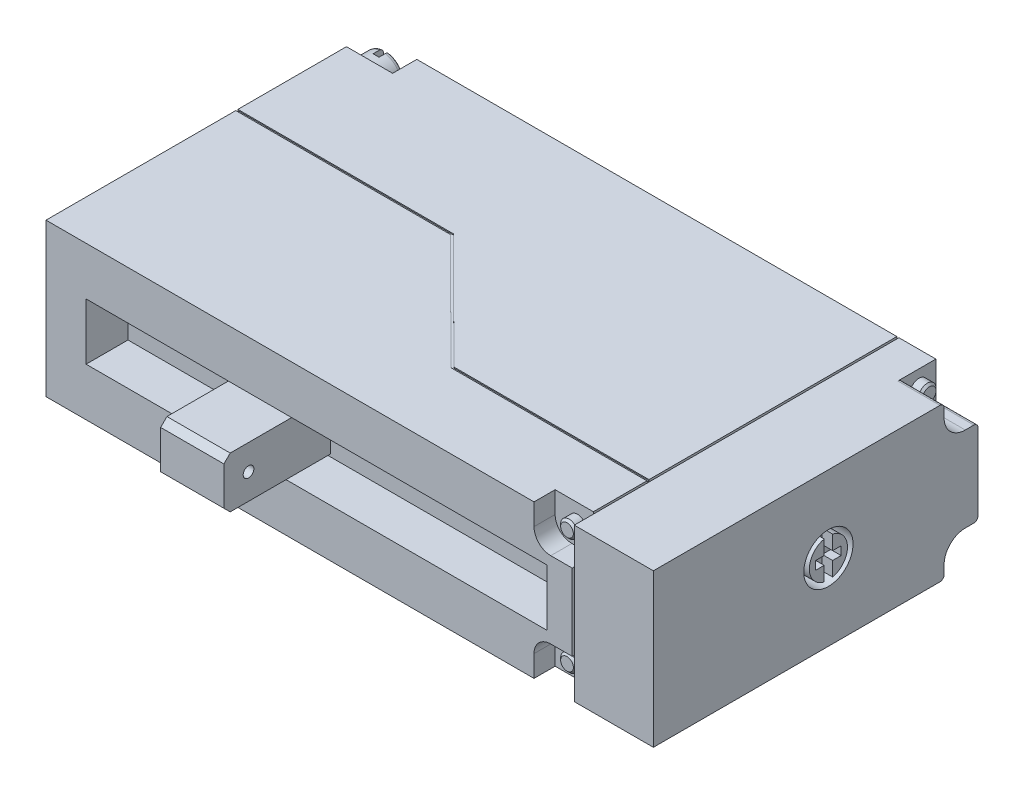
SolidWorks part; units mm, degrees
ref_plane "Front Plane" through (0, 0, 0) normal (0, 0, 1) x (1, 0, 0)
ref_plane "Top Plane" through (0, 0, 0) normal (0, 1, 0) x (1, 0, 0)
ref_plane "Right Plane" through (0, 0, 0) normal (1, 0, 0) x (0, 0, -1)
sketch "Sketch1" plane through (0, 0, 0) normal (0, 0, 1) x (1, 0, 0)
  line L1 (14.5, -3.65) -> (-14.5, -3.65)
  line L2 (14.5, -3.65) -> (14.5, 3.65)
  line L3 (14.5, 3.65) -> (-14.5, 3.65)
  line L4 (-14.5, -3.65) -> (-14.5, 3.65)
  line L5 (14.5, -3.65) -> (-14.5, 3.65) construction
  line L6 (14.5, 3.65) -> (-14.5, -3.65) construction
  point P0 (0, 0)
  dimension "D1" = 29
  dimension "D2" = 7.3
extrude "Boss-Extrude1" add sketch "Sketch1" along normal blind 15.5
sketch "Sketch4" plane through (0, 3.65, 0) normal (0, 1, 0) x (1, 0, 0)
  line L0 (14.5, -15.5) -> (14.5, 0) construction
  line L1 (14.5, 0) -> (-14.5, 0) construction
  line B0 (-14.3994, -0.4521) -> (-14.3994, -0.9538)
  line B1 (-12.5864, -0.9538) -> (-12.5864, -0.4521)
  line B2 (-12.7876, -1.1539) -> (-12.7544, -1.1517)
  line B3 (-12.7544, -1.1517) -> (-12.7188, -1.142)
  line B4 (-12.7188, -1.142) -> (-12.6882, -1.1281)
  line B5 (-12.6882, -1.1281) -> (-12.6597, -1.1067)
  line B6 (-12.6597, -1.1067) -> (-12.6336, -1.0831)
  line B7 (-12.6336, -1.0831) -> (-12.6147, -1.0526)
  line B8 (-12.6147, -1.0526) -> (-12.5982, -1.0219)
  line B9 (-12.5982, -1.0219) -> (-12.5887, -0.9891)
  line B10 (-14.3994, -0.9538) -> (-14.3972, -0.9891)
  line B11 (-14.3972, -0.9891) -> (-14.3874, -1.022)
  line B12 (-14.3874, -1.022) -> (-14.3735, -1.0527)
  line B13 (-14.3735, -1.0527) -> (-14.352, -1.083)
  line B14 (-14.352, -1.083) -> (-14.3283, -1.1066)
  line B15 (-14.3283, -1.1066) -> (-14.2975, -1.1282)
  line B16 (-14.2975, -1.1282) -> (-14.2668, -1.142)
  line B17 (-14.2668, -1.142) -> (-14.2339, -1.1518)
  line B18 (-14.2339, -1.1518) -> (-14.1982, -1.1539)
  line B19 (-14.1983, -0.252) -> (-14.2339, -0.2542)
  line B20 (-14.2339, -0.2542) -> (-14.2669, -0.2635)
  line B21 (-14.2669, -0.2635) -> (-14.2976, -0.2778)
  line B22 (-14.2976, -0.2778) -> (-14.3282, -0.2988)
  line B23 (-14.3282, -0.2988) -> (-14.3519, -0.3224)
  line B24 (-14.3519, -0.3224) -> (-14.3735, -0.3509)
  line B25 (-14.3735, -0.3509) -> (-14.3875, -0.3837)
  line B26 (-14.3875, -0.3837) -> (-14.3972, -0.4169)
  line B27 (-14.3972, -0.4169) -> (-14.3994, -0.4521)
  line B28 (-12.5864, -0.4521) -> (-12.5889, -0.4168)
  line B29 (-12.5889, -0.4168) -> (-12.5984, -0.3837)
  line B30 (-12.5984, -0.3837) -> (-12.6147, -0.3508)
  line B31 (-12.6147, -0.3508) -> (-12.6336, -0.3225)
  line B32 (-12.6336, -0.3225) -> (-12.6598, -0.299)
  line B33 (-12.6598, -0.299) -> (-12.6881, -0.2777)
  line B34 (-12.6881, -0.2777) -> (-12.7189, -0.2635)
  line B35 (-12.7189, -0.2635) -> (-12.7543, -0.2542)
  line B36 (-12.7543, -0.2542) -> (-12.7876, -0.252)
  line B37 (-14.5013, -11.3824) -> (-14.6006, -11.3824)
  line B38 (-14.6006, -12.3856) -> (-14.5013, -12.3856)
  line B39 (-14.6006, -11.3824) -> (-14.7024, -11.4837)
  line B40 (10.2728, -14.7924) -> (10.2728, -14.4911)
  line B41 (9.4658, -14.7924) -> (9.6669, -14.9929)
  line B42 (12.8907, -0.5534) -> (12.4885, -0.5534)
  line B43 (12.8907, -1.3543) -> (12.9902, -1.255)
  line B44 (12.9902, -0.6523) -> (12.8907, -0.5534)
  line B45 (-13.6326, -0.7534) -> (-13.6704, -0.4522)
  line B46 (-13.6326, -0.7534) -> (-13.3533, -0.7534)
  line B47 (-13.3155, -0.4521) -> (-13.3533, -0.7534)
  line B48 (-14.1983, -0.252) -> (-13.694, -0.252)
  line B49 (-13.694, -0.252) -> (-13.694, -0.2542)
  line B50 (-13.694, -0.2542) -> (-13.694, -0.259)
  line B51 (-13.694, -0.259) -> (-13.6918, -0.2661)
  line B52 (-13.6918, -0.2661) -> (-13.6918, -0.2756)
  line B53 (-13.6918, -0.2756) -> (-13.6894, -0.2849)
  line B54 (-13.6894, -0.2849) -> (-13.6869, -0.3085)
  line B55 (-13.6869, -0.3085) -> (-13.6844, -0.339)
  line B56 (-13.6844, -0.339) -> (-13.6801, -0.3745)
  line B57 (-13.6801, -0.3745) -> (-13.6751, -0.4123)
  line B58 (-13.3155, -0.4521) -> (-13.3105, -0.4123)
  line B59 (-13.3105, -0.4123) -> (-13.306, -0.3744)
  line B60 (-13.306, -0.3744) -> (-13.3035, -0.3392)
  line B61 (-13.3035, -0.3392) -> (-13.299, -0.3084)
  line B62 (-13.299, -0.3084) -> (-13.2964, -0.2849)
  line B63 (-13.2964, -0.2849) -> (-13.294, -0.2756)
  line B64 (-13.294, -0.2756) -> (-13.294, -0.2663)
  line B65 (-13.294, -0.2663) -> (-13.2918, -0.2589)
  line B66 (-13.2918, -0.2589) -> (-13.2918, -0.2542)
  line B67 (-13.2918, -0.2542) -> (-13.2918, -0.252)
  line B68 (-13.694, -0.252) -> (-14.0964, -0.252)
  line B69 (-12.8892, -0.252) -> (-13.2918, -0.252)
  line B70 (-5.926, -18.219) -> (-2.9059, -18.219)
  line B71 (-2.9059, -18.219) -> (-2.9059, -15.4944)
  line B72 (-5.926, -18.219) -> (-5.926, -15.4944)
  line B73 (-2.9059, -18.5206) -> (-5.9261, -18.5206)
  line B74 (13.9983, -15.4944) -> (10.6752, -15.4944)
  line B75 (10.6752, -15.4944) -> (10.6752, -15.2939)
  line B76 (10.6752, 0) -> (12.4884, 0)
  line B77 (12.4884, 0) -> (12.4884, -1.7546)
  line B78 (10.6752, -0.3509) -> (10.6752, -15.2939)
  line B79 (14.5, -1.9571) -> (14.5, -15.294)
  line B80 (14.5, -1.9571) -> (14.4978, -1.9218)
  line B81 (14.4978, -1.9218) -> (14.4883, -1.8887)
  line B82 (14.4883, -1.8887) -> (14.4742, -1.8558)
  line B83 (14.4742, -1.8558) -> (14.4551, -1.8275)
  line B84 (14.4551, -1.8275) -> (14.4292, -1.8017)
  line B85 (14.4292, -1.8017) -> (14.4008, -1.7827)
  line B86 (14.4008, -1.7827) -> (14.3676, -1.7684)
  line B87 (14.3676, -1.7684) -> (14.3343, -1.7592)
  line B88 (14.3343, -1.7592) -> (14.2991, -1.7548)
  line B89 (14.299, -15.4944) -> (14.3345, -15.492)
  line B90 (14.3345, -15.492) -> (14.3677, -15.4827)
  line B91 (14.3677, -15.4827) -> (14.4007, -15.4685)
  line B92 (14.4007, -15.4685) -> (14.4291, -15.4473)
  line B93 (14.4291, -15.4473) -> (14.4552, -15.4239)
  line B94 (14.4552, -15.4239) -> (14.4741, -15.3954)
  line B95 (14.4741, -15.3954) -> (14.4884, -15.3623)
  line B96 (14.4884, -15.3623) -> (14.4978, -15.3294)
  line B97 (14.299, -15.4944) -> (13.9983, -15.4944)
  line B98 (12.4884, 0) -> (14.2992, 0)
  line B99 (14.5, -0.2002) -> (14.5, -0.7534)
  line B100 (14.5, -0.2002) -> (14.4978, -0.1671)
  line B101 (14.4978, -0.1671) -> (14.4883, -0.1317)
  line B102 (14.4883, -0.1317) -> (14.4742, -0.1011)
  line B103 (14.4742, -0.1011) -> (14.4551, -0.0726)
  line B104 (14.4551, -0.0726) -> (14.4292, -0.0469)
  line B105 (14.4292, -0.0469) -> (14.4008, -0.0281)
  line B106 (14.4008, -0.0281) -> (14.3676, -0.0118)
  line B107 (14.3676, -0.0118) -> (14.3343, -0.0045)
  line B108 (-14.5013, -6.3893) -> (-13.997, -6.3893)
  line B109 (-14.5013, -1.1539) -> (-13.997, -1.1539)
  line B110 (10.6752, -11.884) -> (1.2905, -11.884)
  line B111 (-4.229, -6.3893) -> (1.2906, -11.884)
  line B112 (10.6752, -11.884) -> (10.6752, 0)
  line B113 (-4.229, -6.3893) -> (-13.997, -6.3893)
  line B114 (-13.997, -1.1539) -> (-12.2953, -1.1539)
  line B115 (-12.0939, 0) -> (-12.1272, -0.0043)
  line B116 (-12.1272, -0.0043) -> (-12.1627, -0.0119)
  line B117 (-12.1627, -0.0119) -> (-12.1934, -0.0281)
  line B118 (-12.1934, -0.0281) -> (-12.222, -0.0467)
  line B119 (-12.222, -0.0467) -> (-12.2479, -0.0727)
  line B120 (-12.2479, -0.0727) -> (-12.267, -0.1012)
  line B121 (-12.267, -0.1012) -> (-12.2835, -0.1317)
  line B122 (-12.2835, -0.1317) -> (-12.2905, -0.1672)
  line B123 (-12.0939, 0) -> (10.6752, 0)
  line B124 (9.4658, -14.7924) -> (10.2728, -14.7924)
  line B125 (12.8907, -1.3543) -> (12.8907, -0.5534)
  line B126 (-13.4787, 0) -> (-12.0939, 0)
  line B127 (-14.2976, 0) -> (-14.3332, -0.0043)
  line B128 (-14.3332, -0.0043) -> (-14.3686, -0.0119)
  line B129 (-14.3686, -0.0119) -> (-14.3994, -0.0281)
  line B130 (-14.3994, -0.0281) -> (-14.4277, -0.0467)
  line B131 (-14.4277, -0.0467) -> (-14.4539, -0.0727)
  line B132 (-14.4539, -0.0727) -> (-14.4728, -0.1012)
  line B133 (-14.4728, -0.1012) -> (-14.4869, -0.1317)
  line B134 (-14.4869, -0.1317) -> (-14.4965, -0.1672)
  line B135 (-14.4965, -0.1672) -> (-14.5012, -0.2002)
  line B136 (-13.997, -15.4944) -> (-14.2976, -15.4944)
  line B137 (-14.5013, -15.294) -> (-14.4966, -15.3295)
  line B138 (-14.4966, -15.3295) -> (-14.487, -15.3623)
  line B139 (-14.487, -15.3623) -> (-14.4727, -15.3954)
  line B140 (-14.4727, -15.3954) -> (-14.454, -15.4238)
  line B141 (-14.454, -15.4238) -> (-14.4277, -15.4471)
  line B142 (-14.4277, -15.4471) -> (-14.3993, -15.4685)
  line B143 (-14.3993, -15.4685) -> (-14.3686, -15.4828)
  line B144 (-14.3686, -15.4828) -> (-14.333, -15.4921)
  line B145 (-14.5013, -6.3893) -> (-13.997, -6.3893)
  line B146 (-14.5013, -15.294) -> (-14.5013, -6.3893)
  line B147 (10.6752, -11.884) -> (1.2905, -11.884)
  line B148 (10.6752, -14.4911) -> (10.6752, -11.884)
  line B149 (8.8717, -14.4911) -> (10.6752, -14.4911)
  line B150 (-4.229, -6.3893) -> (-13.997, -6.3893)
  line B151 (8.5995, -15.4944) -> (8.6373, -15.492)
  line B152 (8.6373, -15.492) -> (8.6729, -15.4804)
  line B153 (8.6729, -15.4804) -> (8.7061, -15.4637)
  line B154 (8.7061, -15.4637) -> (8.7346, -15.4425)
  line B155 (8.7346, -15.4425) -> (8.7604, -15.4144)
  line B156 (8.7604, -15.4144) -> (8.7793, -15.3835)
  line B157 (8.7793, -15.3835) -> (8.7936, -15.3486)
  line B158 (8.7936, -15.3486) -> (8.8006, -15.3106)
  line B159 (9.88, -15.4944) -> (8.5995, -15.4944)
  line B160 (10.6752, -15.4944) -> (9.88, -15.4944)
  line B161 (-14.2976, -1.1281) -> (-14.2976, -1.1539)
  line B162 (14.5, -15.294) -> (14.4957, -15.294)
  line B163 (-14.5013, -15.294) -> (-14.5057, -15.294)
  spline B164 degree 2 poles (-12.5887, -0.9891) (-12.5865, -0.9538) (-12.5864, -0.9538) knots 0.8 0.8 0.8 1 1 1
  spline B165 degree 2 poles (-14.7024, -12.2866) (-14.6005, -12.3856) (-14.6006, -12.3856) knots 0 0 0 1 1 1
  spline B166 degree 2 poles (9.4658, -14.4911) (9.4658, -14.7923) (9.4658, -14.7924) knots 0 0 0 1 1 1
  spline B167 degree 2 poles (10.0693, -14.9928) (10.2727, -14.7924) (10.2728, -14.7924) knots 0 0 0 1 1 1
  spline B168 degree 2 poles (12.4884, -1.3543) (12.8906, -1.3543) (12.8907, -1.3543) knots 0 0 0 1 1 1
  spline B169 degree 2 poles (-13.6751, -0.4123) (-13.6705, -0.4521) (-13.6704, -0.4522) knots 0.818182 0.818182 0.818182 1 1 1
  spline B170 degree 2 poles (-13.2918, -0.252) (-12.7875, -0.252) (-12.7876, -0.252) knots 0 0 0 1 1 1
  spline B171 degree 2 poles (-2.9059, -18.219) (-2.9059, -18.5205) (-2.9059, -18.5206) knots 0 0 0 1 1 1
  spline B172 degree 2 poles (-5.9261, -18.5206) (-5.926, -18.5206) (-5.926, -18.2191) knots 0 0 0 1 1 1
  spline B173 degree 2 poles (-14.7024, -12.2866) (-14.7024, -11.4836) (-14.7024, -11.4837) knots 0 0 0 1 1 1
  spline B174 degree 2 poles (12.4884, -1.7546) (12.4884, -1.7547) (13.9984, -1.7547) knots 0 0 0 1 1 1
  spline B175 degree 2 poles (13.9984, -1.7547) (13.9983, -1.7547) (14.2991, -1.7547) knots 0 0 0 1 1 1
  spline B176 degree 2 poles (14.4978, -15.3294) (14.5, -15.2939) (14.5, -15.294) knots 0.8 0.8 0.8 1 1 1
  spline B177 degree 2 poles (14.5, -0.7534) (14.5, -1.957) (14.5, -1.9571) knots 0 0 0 1 1 1
  spline B178 degree 2 poles (14.3343, -0.0045) (14.2991, 0) (14.2992, 0) knots 0.8 0.8 0.8 1 1 1
  spline B179 degree 2 poles (-14.5013, -6.3893) (-14.5013, -1.1538) (-14.5013, -1.1539) knots 0 0 0 1 1 1
  spline B180 degree 2 poles (-12.2905, -0.1672) (-12.2954, -0.2002) (-12.2954, -0.2003) knots 0.8 0.8 0.8 1 1 1
  spline B181 degree 2 poles (-12.2953, -1.1539) (-12.2954, -1.1539) (-12.2954, -0.2003) knots 0 0 0 1 1 1
  spline B182 degree 2 poles (10.0693, -14.9928) (9.667, -14.9928) (9.6669, -14.9929) knots 0 0 0 1 1 1
  spline B183 degree 2 poles (12.9902, -0.6523) (12.9902, -1.2551) (12.9902, -1.255) knots 0 0 0 1 1 1
  spline B184 degree 2 poles (-14.5013, -1.1539) (-14.5013, -0.2003) (-14.5012, -0.2002) knots 0 0 0 1 1 1
  spline B185 degree 2 poles (-14.2976, 0) (-13.4788, 0) (-13.4787, 0) knots 0 0 0 1 1 1
  spline B186 degree 2 poles (-14.5013, -5.5862) (-14.5013, -6.3894) (-14.5013, -6.3893) knots 0 0 0 1 1 1
  spline B187 degree 2 poles (-14.333, -15.4921) (-14.2976, -15.4945) (-14.2976, -15.4944) knots 0.8 0.8 0.8 1 1 1
  spline B188 degree 2 poles (8.5995, -15.4944) (-13.9971, -15.4944) (-13.997, -15.4944) knots 0 0 0 1 1 1
  spline B189 degree 2 poles (1.2906, -11.884) (-4.229, -6.3894) (-4.229, -6.3893) knots 0 0 0 1 1 1
  spline B190 degree 2 poles (8.8717, -14.4911) (8.8007, -15.3107) (8.8006, -15.3106) knots 0 0 0 1 1 1
sketch_block_instance "Block1-1"
sketch_block "Block1"
ref_plane "Central plane" through (0, 0, 0) normal (0, 1, 0) x (1, 0, 0)
sketch "Sketch5" plane through (14.5, 0, 0) normal (1, 0, 0) x (0, 0, -1)
  line L0 (-1.9571, 3.65) -> (-15.294, 3.65) construction
  line L1 (0, -3.65) -> (0, 3.65) construction
  line B0 (-7.3201, 0.8942) -> (-7.3939, 0.8775)
  line B1 (-7.3939, 0.8775) -> (-7.4654, 0.8535)
  line B2 (-7.4654, 0.8535) -> (-7.5368, 0.8227)
  line B3 (-7.5368, 0.8227) -> (-7.6034, 0.787)
  line B4 (-7.6034, 0.787) -> (-7.6672, 0.7463)
  line B5 (-7.6672, 0.7463) -> (-7.7268, 0.6986)
  line B6 (-7.7268, 0.6986) -> (-7.7839, 0.6485)
  line B7 (-7.7839, 0.6485) -> (-7.8339, 0.5936)
  line B8 (-7.8339, 0.5936) -> (-7.8817, 0.5342)
  line B9 (-7.8817, 0.5342) -> (-7.9246, 0.4698)
  line B10 (-7.9246, 0.4698) -> (-7.9602, 0.4031)
  line B11 (-7.9602, 0.4031) -> (-7.9912, 0.334)
  line B12 (-7.9912, 0.334) -> (-8.0148, 0.2625)
  line B13 (-8.0148, 0.2625) -> (-8.034, 0.1885)
  line B14 (-8.034, 0.1885) -> (-8.0456, 0.1122)
  line B15 (-8.0456, 0.1122) -> (-8.0528, 0.0385)
  line B16 (-8.0528, 0.0385) -> (-8.0528, -0.0379)
  line B17 (-8.0528, -0.0379) -> (-8.0456, -0.1142)
  line B18 (-8.0456, -0.1142) -> (-8.034, -0.1905)
  line B19 (-8.034, -0.1905) -> (-8.0148, -0.2621)
  line B20 (-8.0148, -0.2621) -> (-7.9912, -0.336)
  line B21 (-7.9912, -0.336) -> (-7.9602, -0.4052)
  line B22 (-7.9602, -0.4052) -> (-7.9246, -0.4718)
  line B23 (-7.9246, -0.4718) -> (-7.8817, -0.5337)
  line B24 (-7.8817, -0.5337) -> (-7.8339, -0.5935)
  line B25 (-7.8339, -0.5935) -> (-7.7839, -0.6506)
  line B26 (-7.7839, -0.6506) -> (-7.7268, -0.7007)
  line B27 (-7.7268, -0.7007) -> (-7.6672, -0.7485)
  line B28 (-7.6672, -0.7485) -> (-7.6034, -0.789)
  line B29 (-7.6034, -0.789) -> (-7.5368, -0.8249)
  line B30 (-7.5368, -0.8249) -> (-7.4654, -0.8533)
  line B31 (-7.4654, -0.8533) -> (-7.3939, -0.8769)
  line B32 (-7.3939, -0.8769) -> (-7.3201, -0.8962)
  line B33 (-7.3201, 0.8942) -> (-7.3249, 0.8893)
  line B34 (-7.3249, 0.8893) -> (-7.3273, 0.8846)
  line B35 (-7.3273, 0.8846) -> (-7.3297, 0.8775)
  line B36 (-7.3297, 0.8775) -> (-7.3319, 0.8679)
  line B37 (-7.3319, 0.8679) -> (-7.3343, 0.8561)
  line B38 (-7.3343, 0.8561) -> (-7.3367, 0.8296)
  line B39 (-7.3367, 0.8296) -> (-7.3417, 0.7964)
  line B40 (-7.3417, 0.7964) -> (-7.3439, 0.7605)
  line B41 (-7.3439, 0.7605) -> (-7.3439, 0.6796)
  line B42 (-7.3439, -0.6817) -> (-7.3439, -0.7604)
  line B43 (-7.3439, -0.7604) -> (-7.3417, -0.7985)
  line B44 (-7.3417, -0.7985) -> (-7.3367, -0.8295)
  line B45 (-7.3367, -0.8295) -> (-7.3343, -0.858)
  line B46 (-7.3343, -0.858) -> (-7.3317, -0.8676)
  line B47 (-7.3317, -0.8676) -> (-7.3297, -0.8771)
  line B48 (-7.3297, -0.8771) -> (-7.3273, -0.8867)
  line B49 (-7.3273, -0.8867) -> (-7.3249, -0.8915)
  line B50 (-7.3249, -0.8915) -> (-7.3201, -0.8962)
  line B51 (-7.3201, -0.8962) -> (-7.2823, -0.9035)
  line B52 (-7.344, -0.2025) -> (-7.3439, -0.6817)
  line B53 (-6.9396, 0.6795) -> (-6.9396, 0.7201)
  line B54 (-6.9396, 0.7201) -> (-6.9418, 0.7606)
  line B55 (-6.9418, 0.7606) -> (-6.9442, 0.7964)
  line B56 (-6.9442, 0.7964) -> (-6.9466, 0.8297)
  line B57 (-6.9466, 0.8297) -> (-6.9512, 0.8559)
  line B58 (-6.9512, 0.8559) -> (-6.9512, 0.868)
  line B59 (-6.9512, 0.868) -> (-6.9536, 0.8752)
  line B60 (-6.9536, 0.8752) -> (-6.956, 0.8846)
  line B61 (-6.956, 0.8846) -> (-6.9586, 0.8894)
  line B62 (-6.9586, 0.8894) -> (-6.9608, 0.8918)
  line B63 (-6.9608, 0.8918) -> (-6.9632, 0.8942)
  line B64 (-6.9633, -0.8962) -> (-6.8897, -0.877)
  line B65 (-6.8897, -0.877) -> (-6.8182, -0.8534)
  line B66 (-6.8182, -0.8534) -> (-6.7492, -0.8249)
  line B67 (-6.7492, -0.8249) -> (-6.6827, -0.789)
  line B68 (-6.6827, -0.789) -> (-6.6181, -0.7486)
  line B69 (-6.6181, -0.7486) -> (-6.5567, -0.7007)
  line B70 (-6.5567, -0.7007) -> (-6.5015, -0.6506)
  line B71 (-6.5015, -0.6506) -> (-6.4494, -0.5935)
  line B72 (-6.4494, -0.5935) -> (-6.4016, -0.5338)
  line B73 (-6.4016, -0.5338) -> (-6.3612, -0.4719)
  line B74 (-6.3612, -0.4719) -> (-6.3234, -0.4052)
  line B75 (-6.3234, -0.4052) -> (-6.2949, -0.336)
  line B76 (-6.2949, -0.336) -> (-6.2685, -0.2621)
  line B77 (-6.2685, -0.2621) -> (-6.2495, -0.1906)
  line B78 (-6.2495, -0.1906) -> (-6.2375, -0.1143)
  line B79 (-6.2375, -0.1143) -> (-6.2305, -0.0379)
  line B80 (-6.2305, -0.0379) -> (-6.2305, 0.0385)
  line B81 (-6.2305, 0.0385) -> (-6.2375, 0.1122)
  line B82 (-6.2375, 0.1122) -> (-6.2495, 0.1885)
  line B83 (-6.2495, 0.1885) -> (-6.2685, 0.2625)
  line B84 (-6.2685, 0.2625) -> (-6.2949, 0.334)
  line B85 (-6.2949, 0.334) -> (-6.3234, 0.4031)
  line B86 (-6.3234, 0.4031) -> (-6.3612, 0.4698)
  line B87 (-6.3612, 0.4698) -> (-6.4016, 0.5341)
  line B88 (-6.4016, 0.5341) -> (-6.4494, 0.5938)
  line B89 (-6.4494, 0.5938) -> (-6.5015, 0.6485)
  line B90 (-6.5015, 0.6485) -> (-6.5567, 0.6986)
  line B91 (-6.5567, 0.6986) -> (-6.6181, 0.7463)
  line B92 (-6.6181, 0.7463) -> (-6.6827, 0.7869)
  line B93 (-6.6827, 0.7869) -> (-6.7492, 0.8226)
  line B94 (-6.7492, 0.8226) -> (-6.8182, 0.8535)
  line B95 (-6.8182, 0.8535) -> (-6.8897, 0.8775)
  line B96 (-6.8897, 0.8775) -> (-6.9633, 0.8942)
  line B97 (-6.9633, -0.8962) -> (-6.9587, -0.8914)
  line B98 (-6.9587, -0.8914) -> (-6.9561, -0.8842)
  line B99 (-6.9561, -0.8842) -> (-6.9536, -0.877)
  line B100 (-6.9536, -0.877) -> (-6.9511, -0.8676)
  line B101 (-6.9511, -0.8676) -> (-6.9511, -0.8581)
  line B102 (-6.9511, -0.8581) -> (-6.9467, -0.8295)
  line B103 (-6.9467, -0.8295) -> (-6.9443, -0.7985)
  line B104 (-6.9443, -0.7985) -> (-6.9418, -0.7604)
  line B105 (-6.9418, -0.7604) -> (-6.9397, -0.7221)
  line B106 (-6.9397, -0.7221) -> (-6.9397, -0.6816)
  line B107 (-6.9633, 0.8942) -> (-7.0011, 0.9014)
  line B108 (-6.9395, 0.2027) -> (-6.9396, 0.6795)
  line B109 (-7.2821, 0.9013) -> (-7.32, 0.8941)
  line B110 (-7.3439, 0.6796) -> (-7.3439, 0.2028)
  line B111 (-7.0012, -0.9033) -> (-6.9633, -0.8962)
  line B112 (-6.9397, -0.6816) -> (-6.9396, -0.2025)
  line B113 (-6.5352, -0.2025) -> (-6.5352, 0.2026)
  line B114 (-6.5352, 0.2026) -> (-6.9395, 0.2027)
  line B115 (-7.3439, 0.2028) -> (-7.7507, 0.2027)
  line B116 (-7.7507, 0.2027) -> (-7.7508, -0.2024)
  line B117 (-7.7508, -0.2024) -> (-7.344, -0.2025)
  line B118 (-6.9396, -0.2025) -> (-6.5352, -0.2025)
  line B119 (-7.0011, 0.9014) -> (-7.0726, 0.9085)
  line B120 (-7.0726, 0.9085) -> (-7.1417, 0.9133)
  line B121 (-7.1417, 0.9133) -> (-7.2131, 0.9085)
  line B122 (-7.2131, 0.9085) -> (-7.2821, 0.9013)
  line B123 (-7.2823, -0.9035) -> (-7.213, -0.9106)
  line B124 (-7.213, -0.9106) -> (-7.1417, -0.9128)
  line B125 (-7.1417, -0.9128) -> (-7.0727, -0.9106)
  line B126 (-7.0727, -0.9106) -> (-7.0012, -0.9033)
  line B127 (-15.4993, -1.2181) -> (-18.2516, -1.2181)
  line B128 (-18.5562, -0.9128) -> (-18.2516, -1.2181)
  line B129 (-18.5562, -0.9128) -> (-18.5562, 0.9132)
  line B130 (-18.2516, 1.216) -> (-18.5562, 0.9132)
  line B131 (-18.2516, 1.216) -> (-15.4993, 1.216)
  line B132 (-17.4241, 0.3029) -> (-17.4667, 0.3007)
  line B133 (-17.4667, 0.3007) -> (-17.5095, 0.2908)
  line B134 (-17.5095, 0.2908) -> (-17.5501, 0.2767)
  line B135 (-17.5501, 0.2767) -> (-17.588, 0.2552)
  line B136 (-17.588, 0.2552) -> (-17.6238, 0.2289)
  line B137 (-17.6238, 0.2289) -> (-17.6548, 0.1981)
  line B138 (-17.6548, 0.1981) -> (-17.6808, 0.1647)
  line B139 (-17.6808, 0.1647) -> (-17.7, 0.1265)
  line B140 (-17.7, 0.1265) -> (-17.7166, 0.0859)
  line B141 (-17.7166, 0.0859) -> (-17.726, 0.043)
  line B142 (-17.726, 0.043) -> (-17.7284, 0.0001)
  line B143 (-17.7284, 0.0001) -> (-17.726, -0.0451)
  line B144 (-17.726, -0.0451) -> (-17.7166, -0.0856)
  line B145 (-17.7166, -0.0856) -> (-17.7, -0.1263)
  line B146 (-17.7, -0.1263) -> (-17.6808, -0.1644)
  line B147 (-17.6808, -0.1644) -> (-17.6548, -0.2)
  line B148 (-17.6548, -0.2) -> (-17.6238, -0.2311)
  line B149 (-17.6238, -0.2311) -> (-17.588, -0.2573)
  line B150 (-17.588, -0.2573) -> (-17.5501, -0.2763)
  line B151 (-17.5501, -0.2763) -> (-17.5095, -0.2932)
  line B152 (-17.5095, -0.2932) -> (-17.4667, -0.3026)
  line B153 (-17.4667, -0.3026) -> (-17.4241, -0.305)
  line B154 (-17.4241, -0.305) -> (-17.3811, -0.3026)
  line B155 (-17.3811, -0.3026) -> (-17.3382, -0.2932)
  line B156 (-17.3382, -0.2932) -> (-17.2976, -0.2763)
  line B157 (-17.2976, -0.2763) -> (-17.26, -0.2573)
  line B158 (-17.26, -0.2573) -> (-17.2242, -0.2311)
  line B159 (-17.2242, -0.2311) -> (-17.1954, -0.2)
  line B160 (-17.1954, -0.2) -> (-17.1695, -0.1644)
  line B161 (-17.1695, -0.1644) -> (-17.1482, -0.1263)
  line B162 (-17.1482, -0.1263) -> (-17.1339, -0.0856)
  line B163 (-17.1339, -0.0856) -> (-17.1243, -0.0451)
  line B164 (-17.1243, -0.0451) -> (-17.1195, 0.0001)
  line B165 (-17.1195, 0.0001) -> (-17.1243, 0.043)
  line B166 (-17.1243, 0.043) -> (-17.1339, 0.0859)
  line B167 (-17.1339, 0.0859) -> (-17.1482, 0.1265)
  line B168 (-17.1482, 0.1265) -> (-17.1695, 0.1647)
  line B169 (-17.1695, 0.1647) -> (-17.1954, 0.1981)
  line B170 (-17.1954, 0.1981) -> (-17.2242, 0.2289)
  line B171 (-17.2242, 0.2289) -> (-17.26, 0.2552)
  line B172 (-17.26, 0.2552) -> (-17.2976, 0.2767)
  line B173 (-17.2976, 0.2767) -> (-17.3382, 0.2908)
  line B174 (-17.3382, 0.2908) -> (-17.3811, 0.3007)
  line B175 (-17.3811, 0.3007) -> (-17.4241, 0.3029)
  line B176 (-0.2021, -2.0286) -> (-0.6087, -2.0286)
  line B177 (-7.1417, 1.1754) -> (-7.2295, 1.1708)
  line B178 (-7.2295, 1.1708) -> (-7.3179, 1.1612)
  line B179 (-7.3179, 1.1612) -> (-7.4034, 1.1444)
  line B180 (-7.4034, 1.1444) -> (-7.489, 1.1232)
  line B181 (-7.489, 1.1232) -> (-7.5701, 1.0945)
  line B182 (-7.5701, 1.0945) -> (-7.6509, 1.0586)
  line B183 (-7.6509, 1.0586) -> (-7.7296, 1.0181)
  line B184 (-7.7296, 1.0181) -> (-7.803, 0.9704)
  line B185 (-7.803, 0.9704) -> (-7.8744, 0.918)
  line B186 (-7.8744, 0.918) -> (-7.9412, 0.8607)
  line B187 (-7.9412, 0.8607) -> (-8.0029, 0.7988)
  line B188 (-8.0029, 0.7988) -> (-8.0601, 0.732)
  line B189 (-8.0601, 0.732) -> (-8.1125, 0.6605)
  line B190 (-8.1125, 0.6605) -> (-8.1576, 0.5866)
  line B191 (-8.1576, 0.5866) -> (-8.2004, 0.5102)
  line B192 (-8.2004, 0.5102) -> (-8.2336, 0.4291)
  line B193 (-8.2336, 0.4291) -> (-8.2644, 0.3458)
  line B194 (-8.2644, 0.3458) -> (-8.2858, 0.26)
  line B195 (-8.2858, 0.26) -> (-8.3026, 0.1741)
  line B196 (-8.3026, 0.1741) -> (-8.3122, 0.0859)
  line B197 (-8.3122, 0.0859) -> (-8.317, 0.0001)
  line B198 (-8.317, 0.0001) -> (-8.3122, -0.0882)
  line B199 (-8.3122, -0.0882) -> (-8.3026, -0.1762)
  line B200 (-8.3026, -0.1762) -> (-8.2858, -0.2621)
  line B201 (-8.2858, -0.2621) -> (-8.2644, -0.3481)
  line B202 (-8.2644, -0.3481) -> (-8.2336, -0.429)
  line B203 (-8.2336, -0.429) -> (-8.2004, -0.5099)
  line B204 (-8.2004, -0.5099) -> (-8.1576, -0.5887)
  line B205 (-8.1576, -0.5887) -> (-8.1125, -0.6624)
  line B206 (-8.1125, -0.6624) -> (-8.0601, -0.7342)
  line B207 (-8.0601, -0.7342) -> (-8.0029, -0.8009)
  line B208 (-8.0029, -0.8009) -> (-7.9412, -0.8628)
  line B209 (-7.9412, -0.8628) -> (-7.8744, -0.9201)
  line B210 (-7.8744, -0.9201) -> (-7.803, -0.9724)
  line B211 (-7.803, -0.9724) -> (-7.7296, -1.0177)
  line B212 (-7.7296, -1.0177) -> (-7.6509, -1.0607)
  line B213 (-7.6509, -1.0607) -> (-7.5701, -1.0942)
  line B214 (-7.5701, -1.0942) -> (-7.489, -1.1226)
  line B215 (-7.489, -1.1226) -> (-7.4034, -1.1465)
  line B216 (-7.4034, -1.1465) -> (-7.3179, -1.1631)
  line B217 (-7.3179, -1.1631) -> (-7.2295, -1.1727)
  line B218 (-7.2295, -1.1727) -> (-7.1417, -1.1752)
  line B219 (-7.1417, -1.1752) -> (-7.0538, -1.1727)
  line B220 (-7.0538, -1.1727) -> (-6.968, -1.1631)
  line B221 (-6.968, -1.1631) -> (-6.88, -1.1465)
  line B222 (-6.88, -1.1465) -> (-6.7967, -1.1226)
  line B223 (-6.7967, -1.1226) -> (-6.7133, -1.0942)
  line B224 (-6.7133, -1.0942) -> (-6.6326, -1.0607)
  line B225 (-6.6326, -1.0607) -> (-6.554, -1.0177)
  line B226 (-6.554, -1.0177) -> (-6.4805, -0.9724)
  line B227 (-6.4805, -0.9724) -> (-6.4113, -0.9201)
  line B228 (-6.4113, -0.9201) -> (-6.3447, -0.8628)
  line B229 (-6.3447, -0.8628) -> (-6.2805, -0.8009)
  line B230 (-6.2805, -0.8009) -> (-6.2234, -0.7342)
  line B231 (-6.2234, -0.7342) -> (-6.1734, -0.6624)
  line B232 (-6.1734, -0.6624) -> (-6.126, -0.5887)
  line B233 (-6.126, -0.5887) -> (-6.0856, -0.5099)
  line B234 (-6.0856, -0.5099) -> (-6.0497, -0.429)
  line B235 (-6.0497, -0.429) -> (-6.0209, -0.3481)
  line B236 (-6.0209, -0.3481) -> (-5.9971, -0.2621)
  line B237 (-5.9971, -0.2621) -> (-5.9805, -0.1762)
  line B238 (-5.9805, -0.1762) -> (-5.9711, -0.0882)
  line B239 (-5.9711, -0.0882) -> (-5.9689, 0.0001)
  line B240 (-5.9689, 0.0001) -> (-5.9711, 0.0859)
  line B241 (-5.9711, 0.0859) -> (-5.9805, 0.1741)
  line B242 (-5.9805, 0.1741) -> (-5.9971, 0.26)
  line B243 (-5.9971, 0.26) -> (-6.0209, 0.3458)
  line B244 (-6.0209, 0.3458) -> (-6.0497, 0.4291)
  line B245 (-6.0497, 0.4291) -> (-6.0856, 0.5102)
  line B246 (-6.0856, 0.5102) -> (-6.126, 0.5866)
  line B247 (-6.126, 0.5866) -> (-6.1734, 0.6605)
  line B248 (-6.1734, 0.6605) -> (-6.2234, 0.732)
  line B249 (-6.2234, 0.732) -> (-6.2805, 0.7988)
  line B250 (-6.2805, 0.7988) -> (-6.3447, 0.8607)
  line B251 (-6.3447, 0.8607) -> (-6.4113, 0.918)
  line B252 (-6.4113, 0.918) -> (-6.4805, 0.9704)
  line B253 (-6.4805, 0.9704) -> (-6.554, 1.0181)
  line B254 (-6.554, 1.0181) -> (-6.6326, 1.0586)
  line B255 (-6.6326, 1.0586) -> (-6.7133, 1.0945)
  line B256 (-6.7133, 1.0945) -> (-6.7967, 1.1232)
  line B257 (-6.7967, 1.1232) -> (-6.88, 1.1444)
  line B258 (-6.88, 1.1444) -> (-6.968, 1.1612)
  line B259 (-6.968, 1.1612) -> (-7.0538, 1.1708)
  line B260 (-7.0538, 1.1708) -> (-7.1417, 1.1754)
  line B261 (-0.6086, 2.0289) -> (-0.2021, 2.029)
  line B262 (-1.8245, -3.6522) -> (-15.2969, -3.6522)
  line B263 (-0.6087, -2.0286) -> (-0.6873, -2.0334)
  line B264 (-0.6873, -2.0334) -> (-0.7658, -2.043)
  line B265 (-0.7658, -2.043) -> (-0.8444, -2.0572)
  line B266 (-0.8444, -2.0572) -> (-0.9205, -2.0787)
  line B267 (-0.9205, -2.0787) -> (-0.9965, -2.1073)
  line B268 (-0.9965, -2.1073) -> (-1.0677, -2.1408)
  line B269 (-1.0677, -2.1408) -> (-1.1367, -2.1789)
  line B270 (-1.1367, -2.1789) -> (-1.2036, -2.2241)
  line B271 (-1.2036, -2.2241) -> (-1.2656, -2.2716)
  line B272 (-1.2656, -2.2716) -> (-1.3248, -2.3265)
  line B273 (-1.3248, -2.3265) -> (-1.3773, -2.3838)
  line B274 (-1.3773, -2.3838) -> (-1.4271, -2.4481)
  line B275 (-1.4271, -2.4481) -> (-1.4721, -2.5126)
  line B276 (-1.4721, -2.5126) -> (-1.5105, -2.5842)
  line B277 (-1.5105, -2.5842) -> (-1.5438, -2.6555)
  line B278 (-1.5438, -2.6555) -> (-1.5723, -2.7294)
  line B279 (-1.5723, -2.7294) -> (-1.5938, -2.8058)
  line B280 (-1.5938, -2.8058) -> (-1.608, -2.8845)
  line B281 (-1.608, -2.8845) -> (-1.6174, -2.9632)
  line B282 (-1.6174, -2.9632) -> (-1.6202, -3.0442)
  line B283 (-1.6201, 3.042) -> (-1.6173, 2.9634)
  line B284 (-1.6173, 2.9634) -> (-1.6079, 2.8825)
  line B285 (-1.6079, 2.8825) -> (-1.5937, 2.8061)
  line B286 (-1.5937, 2.8061) -> (-1.5725, 2.7276)
  line B287 (-1.5725, 2.7276) -> (-1.5437, 2.6536)
  line B288 (-1.5437, 2.6536) -> (-1.5105, 2.5821)
  line B289 (-1.5105, 2.5821) -> (-1.4722, 2.513)
  line B290 (-1.4722, 2.513) -> (-1.427, 2.446)
  line B291 (-1.427, 2.446) -> (-1.3772, 2.3841)
  line B292 (-1.3772, 2.3841) -> (-1.3248, 2.3245)
  line B293 (-1.3248, 2.3245) -> (-1.2657, 2.2698)
  line B294 (-1.2657, 2.2698) -> (-1.2035, 2.2221)
  line B295 (-1.2035, 2.2221) -> (-1.1367, 2.1766)
  line B296 (-1.1367, 2.1766) -> (-1.0677, 2.1385)
  line B297 (-1.0677, 2.1385) -> (-0.9966, 2.1052)
  line B298 (-0.9966, 2.1052) -> (-0.9204, 2.0766)
  line B299 (-0.9204, 2.0766) -> (-0.8443, 2.0551)
  line B300 (-0.8443, 2.0551) -> (-0.7657, 2.0409)
  line B301 (-0.7657, 2.0409) -> (-0.6873, 2.0313)
  line B302 (-0.6873, 2.0313) -> (-0.6086, 2.0289)
  line B303 (-1.6202, -3.0442) -> (-1.6201, -3.1444)
  line B304 (0, 1.8238) -> (0, -1.826)
  line B305 (-15.4993, -3.1444) -> (-15.4993, 3.1446)
  line B306 (-15.2969, 3.65) -> (-1.8244, 3.65)
  line B307 (-1.6201, 3.1446) -> (-1.6201, 3.042)
  line B308 (-15.4993, 3.1446) -> (-15.4993, 3.4474)
  line B309 (-15.2969, 3.65) -> (-15.3327, 3.6476)
  line B310 (-15.3327, 3.6476) -> (-15.3659, 3.638)
  line B311 (-15.3659, 3.638) -> (-15.3993, 3.6238)
  line B312 (-15.3993, 3.6238) -> (-15.428, 3.6024)
  line B313 (-15.428, 3.6024) -> (-15.4516, 3.5785)
  line B314 (-15.4516, 3.5785) -> (-15.4732, 3.5498)
  line B315 (-15.4732, 3.5498) -> (-15.4876, 3.5166)
  line B316 (-15.4876, 3.5166) -> (-15.497, 3.4832)
  line B317 (-15.497, 3.4832) -> (-15.4993, 3.4474)
  line B318 (-1.6201, -3.1444) -> (-1.6201, -3.4495)
  line B319 (-1.8245, -3.6522) -> (-1.7889, -3.6498)
  line B320 (-1.7889, -3.6498) -> (-1.7555, -3.6401)
  line B321 (-1.7555, -3.6401) -> (-1.7223, -3.6259)
  line B322 (-1.7223, -3.6259) -> (-1.6937, -3.6045)
  line B323 (-1.6937, -3.6045) -> (-1.6676, -3.5807)
  line B324 (-1.6676, -3.5807) -> (-1.6484, -3.5496)
  line B325 (-1.6484, -3.5496) -> (-1.634, -3.5185)
  line B326 (-1.634, -3.5185) -> (-1.6246, -3.4853)
  line B327 (-1.6246, -3.4853) -> (-1.6201, -3.4495)
  line B328 (-15.4993, -3.4496) -> (-15.4969, -3.4852)
  line B329 (-15.4969, -3.4852) -> (-15.4875, -3.5187)
  line B330 (-15.4875, -3.5187) -> (-15.4731, -3.5495)
  line B331 (-15.4731, -3.5495) -> (-15.4517, -3.5806)
  line B332 (-15.4517, -3.5806) -> (-15.4281, -3.6044)
  line B333 (-15.4281, -3.6044) -> (-15.3993, -3.6259)
  line B334 (-15.3993, -3.6259) -> (-15.3659, -3.6403)
  line B335 (-15.3659, -3.6403) -> (-15.3327, -3.6497)
  line B336 (-15.3327, -3.6497) -> (-15.2969, -3.6522)
  line B337 (-15.4993, -3.4496) -> (-15.4993, -3.1444)
  line B338 (-1.6201, 3.4474) -> (-1.6201, 3.1446)
  line B339 (-1.6201, 3.4474) -> (-1.6245, 3.4831)
  line B340 (-1.6245, 3.4831) -> (-1.6339, 3.5166)
  line B341 (-1.6339, 3.5166) -> (-1.6485, 3.5498)
  line B342 (-1.6485, 3.5498) -> (-1.6675, 3.5785)
  line B343 (-1.6675, 3.5785) -> (-1.6936, 3.6023)
  line B344 (-1.6936, 3.6023) -> (-1.7224, 3.6237)
  line B345 (-1.7224, 3.6237) -> (-1.7556, 3.6381)
  line B346 (-1.7556, 3.6381) -> (-1.789, 3.6477)
  line B347 (-1.789, 3.6477) -> (-1.8244, 3.65)
  line B348 (-0.2021, -2.0286) -> (-0.1689, -2.0262)
  line B349 (-0.1689, -2.0262) -> (-0.133, -2.0166)
  line B350 (-0.133, -2.0166) -> (-0.1022, -2.0024)
  line B351 (-0.1022, -2.0024) -> (-0.0734, -1.9811)
  line B352 (-0.0734, -1.9811) -> (-0.0474, -1.9573)
  line B353 (-0.0474, -1.9573) -> (-0.0284, -1.9284)
  line B354 (-0.0284, -1.9284) -> (-0.0116, -1.895)
  line B355 (-0.0116, -1.895) -> (-0.0022, -1.8617)
  line B356 (-0.0022, -1.8617) -> (0, -1.826)
  line B357 (0, 1.8238) -> (-0.0022, 1.8597)
  line B358 (-0.0022, 1.8597) -> (-0.0116, 1.8954)
  line B359 (-0.0116, 1.8954) -> (-0.0284, 1.9264)
  line B360 (-0.0284, 1.9264) -> (-0.0472, 1.9551)
  line B361 (-0.0472, 1.9551) -> (-0.0735, 1.9813)
  line B362 (-0.0735, 1.9813) -> (-0.1023, 2.0003)
  line B363 (-0.1023, 2.0003) -> (-0.1331, 2.0146)
  line B364 (-0.1331, 2.0146) -> (-0.1689, 2.0242)
  line B365 (-0.1689, 2.0242) -> (-0.2021, 2.029)
  line B366 (0, 3.4474) -> (-0.0022, 3.4831)
  line B367 (-0.0022, 3.4831) -> (-0.0116, 3.5166)
  line B368 (-0.0116, 3.5166) -> (-0.0284, 3.5498)
  line B369 (-0.0284, 3.5498) -> (-0.0472, 3.5785)
  line B370 (-0.0472, 3.5785) -> (-0.0735, 3.6023)
  line B371 (-0.0735, 3.6023) -> (-0.1023, 3.6237)
  line B372 (-0.1023, 3.6237) -> (-0.1331, 3.6381)
  line B373 (-0.1331, 3.6381) -> (-0.1689, 3.6477)
  line B374 (-0.1689, 3.6477) -> (-0.2021, 3.65)
  line B375 (-0.2021, 3.65) -> (-1.8244, 3.65)
  line B376 (0, 1.8238) -> (0, 3.4474)
  line B377 (-0.2021, -3.6522) -> (-0.1689, -3.6498)
  line B378 (-0.1689, -3.6498) -> (-0.133, -3.6401)
  line B379 (-0.133, -3.6401) -> (-0.1022, -3.6259)
  line B380 (-0.1022, -3.6259) -> (-0.0734, -3.6045)
  line B381 (-0.0734, -3.6045) -> (-0.0474, -3.5807)
  line B382 (-0.0474, -3.5807) -> (-0.0284, -3.5496)
  line B383 (-0.0284, -3.5496) -> (-0.0116, -3.5185)
  line B384 (-0.0116, -3.5185) -> (-0.0022, -3.4853)
  line B385 (-0.0022, -3.4853) -> (0, -3.4496)
  line B386 (-1.8245, -3.6522) -> (-0.2021, -3.6522)
  line B387 (0, -3.4496) -> (0, -1.826)
  line B388 (-0.8111, -2.5364) -> (-0.8538, -2.5388)
  line B389 (-0.8538, -2.5388) -> (-0.8966, -2.5484)
  line B390 (-0.8966, -2.5484) -> (-0.9372, -2.5651)
  line B391 (-0.9372, -2.5651) -> (-0.975, -2.5841)
  line B392 (-0.975, -2.5841) -> (-1.011, -2.6103)
  line B393 (-1.011, -2.6103) -> (-1.0395, -2.6412)
  line B394 (-1.0395, -2.6412) -> (-1.0654, -2.6771)
  line B395 (-1.0654, -2.6771) -> (-1.0871, -2.7153)
  line B396 (-1.0871, -2.7153) -> (-1.1013, -2.7558)
  line B397 (-1.1013, -2.7558) -> (-1.1106, -2.7963)
  line B398 (-1.1106, -2.7963) -> (-1.1155, -2.8415)
  line B399 (-1.1155, -2.8415) -> (-1.1106, -2.8844)
  line B400 (-1.1106, -2.8844) -> (-1.1013, -2.9273)
  line B401 (-1.1013, -2.9273) -> (-1.0871, -2.9678)
  line B402 (-1.0871, -2.9678) -> (-1.0654, -3.0061)
  line B403 (-1.0654, -3.0061) -> (-1.0395, -3.0395)
  line B404 (-1.0395, -3.0395) -> (-1.011, -3.0706)
  line B405 (-1.011, -3.0706) -> (-0.975, -3.0966)
  line B406 (-0.975, -3.0966) -> (-0.9372, -3.1181)
  line B407 (-0.9372, -3.1181) -> (-0.8966, -3.1325)
  line B408 (-0.8966, -3.1325) -> (-0.8538, -3.1419)
  line B409 (-0.8538, -3.1419) -> (-0.8111, -3.1443)
  line B410 (-0.8111, -3.1443) -> (-0.7683, -3.1419)
  line B411 (-0.7683, -3.1419) -> (-0.7253, -3.1325)
  line B412 (-0.7253, -3.1325) -> (-0.6849, -3.1181)
  line B413 (-0.6849, -3.1181) -> (-0.6468, -3.0966)
  line B414 (-0.6468, -3.0966) -> (-0.6111, -3.0706)
  line B415 (-0.6111, -3.0706) -> (-0.5804, -3.0395)
  line B416 (-0.5804, -3.0395) -> (-0.554, -3.0061)
  line B417 (-0.554, -3.0061) -> (-0.535, -2.9678)
  line B418 (-0.535, -2.9678) -> (-0.5182, -2.9273)
  line B419 (-0.5182, -2.9273) -> (-0.5088, -2.8844)
  line B420 (-0.5088, -2.8844) -> (-0.5066, -2.8415)
  line B421 (-0.5066, -2.8415) -> (-0.5088, -2.7963)
  line B422 (-0.5088, -2.7963) -> (-0.5182, -2.7558)
  line B423 (-0.5182, -2.7558) -> (-0.535, -2.7153)
  line B424 (-0.535, -2.7153) -> (-0.554, -2.6771)
  line B425 (-0.554, -2.6771) -> (-0.5804, -2.6412)
  line B426 (-0.5804, -2.6412) -> (-0.6111, -2.6103)
  line B427 (-0.6111, -2.6103) -> (-0.6468, -2.5841)
  line B428 (-0.6468, -2.5841) -> (-0.6849, -2.5651)
  line B429 (-0.6849, -2.5651) -> (-0.7253, -2.5484)
  line B430 (-0.7253, -2.5484) -> (-0.7683, -2.5388)
  line B431 (-0.7683, -2.5388) -> (-0.8111, -2.5364)
  line B432 (-0.8111, -2.4338) -> (-0.8585, -2.4386)
  line B433 (-0.8585, -2.4386) -> (-0.9084, -2.4458)
  line B434 (-0.9084, -2.4458) -> (-0.954, -2.4624)
  line B435 (-0.954, -2.4624) -> (-0.9988, -2.4815)
  line B436 (-0.9988, -2.4815) -> (-1.0416, -2.5079)
  line B437 (-1.0416, -2.5079) -> (-1.0801, -2.5364)
  line B438 (-1.0801, -2.5364) -> (-1.1133, -2.5722)
  line B439 (-1.1133, -2.5722) -> (-1.1441, -2.6103)
  line B440 (-1.1441, -2.6103) -> (-1.1703, -2.6532)
  line B441 (-1.1703, -2.6532) -> (-1.1895, -2.6961)
  line B442 (-1.1895, -2.6961) -> (-1.2035, -2.7437)
  line B443 (-1.2035, -2.7437) -> (-1.2129, -2.7914)
  line B444 (-1.2129, -2.7914) -> (-1.2155, -2.8415)
  line B445 (-1.2155, -2.8415) -> (-1.2129, -2.8892)
  line B446 (-1.2129, -2.8892) -> (-1.2035, -2.9369)
  line B447 (-1.2035, -2.9369) -> (-1.1895, -2.9846)
  line B448 (-1.1895, -2.9846) -> (-1.1703, -3.0299)
  line B449 (-1.1703, -3.0299) -> (-1.1441, -3.0705)
  line B450 (-1.1441, -3.0705) -> (-1.1133, -3.1086)
  line B451 (-1.1133, -3.1086) -> (-1.0801, -3.1443)
  line B452 (-1.0801, -3.1443) -> (-1.0416, -3.1753)
  line B453 (-1.0416, -3.1753) -> (-0.9988, -3.1992)
  line B454 (-0.9988, -3.1992) -> (-0.954, -3.2206)
  line B455 (-0.954, -3.2206) -> (-0.9084, -3.235)
  line B456 (-0.9084, -3.235) -> (-0.8585, -3.2444)
  line B457 (-0.8585, -3.2444) -> (-0.8111, -3.2468)
  line B458 (-0.8111, -3.2468) -> (-0.7611, -3.2444)
  line B459 (-0.7611, -3.2444) -> (-0.7133, -3.235)
  line B460 (-0.7133, -3.235) -> (-0.6661, -3.2206)
  line B461 (-0.6661, -3.2206) -> (-0.6233, -3.1992)
  line B462 (-0.6233, -3.1992) -> (-0.5804, -3.1753)
  line B463 (-0.5804, -3.1753) -> (-0.542, -3.1443)
  line B464 (-0.542, -3.1443) -> (-0.5066, -3.1086)
  line B465 (-0.5066, -3.1086) -> (-0.478, -3.0705)
  line B466 (-0.478, -3.0705) -> (-0.4516, -3.0299)
  line B467 (-0.4516, -3.0299) -> (-0.4327, -2.9846)
  line B468 (-0.4327, -2.9846) -> (-0.4159, -2.9369)
  line B469 (-0.4159, -2.9369) -> (-0.409, -2.8892)
  line B470 (-0.409, -2.8892) -> (-0.4068, -2.8415)
  line B471 (-0.4068, -2.8415) -> (-0.409, -2.7914)
  line B472 (-0.409, -2.7914) -> (-0.4159, -2.7437)
  line B473 (-0.4159, -2.7437) -> (-0.4327, -2.6961)
  line B474 (-0.4327, -2.6961) -> (-0.4516, -2.6532)
  line B475 (-0.4516, -2.6532) -> (-0.478, -2.6103)
  line B476 (-0.478, -2.6103) -> (-0.5066, -2.5722)
  line B477 (-0.5066, -2.5722) -> (-0.542, -2.5364)
  line B478 (-0.542, -2.5364) -> (-0.5804, -2.5079)
  line B479 (-0.5804, -2.5079) -> (-0.6233, -2.4815)
  line B480 (-0.6233, -2.4815) -> (-0.6661, -2.4624)
  line B481 (-0.6661, -2.4624) -> (-0.7133, -2.4458)
  line B482 (-0.7133, -2.4458) -> (-0.7611, -2.4386)
  line B483 (-0.7611, -2.4386) -> (-0.8111, -2.4338)
  line B484 (-0.8111, 3.1446) -> (-0.8538, 3.14)
  line B485 (-0.8538, 3.14) -> (-0.8966, 3.1304)
  line B486 (-0.8966, 3.1304) -> (-0.9372, 3.116)
  line B487 (-0.9372, 3.116) -> (-0.975, 3.0946)
  line B488 (-0.975, 3.0946) -> (-1.011, 3.0683)
  line B489 (-1.011, 3.0683) -> (-1.0395, 3.0373)
  line B490 (-1.0395, 3.0373) -> (-1.0654, 3.004)
  line B491 (-1.0654, 3.004) -> (-1.0871, 2.9659)
  line B492 (-1.0871, 2.9659) -> (-1.1013, 2.9254)
  line B493 (-1.1013, 2.9254) -> (-1.1106, 2.8824)
  line B494 (-1.1106, 2.8824) -> (-1.1155, 2.8395)
  line B495 (-1.1155, 2.8395) -> (-1.1106, 2.7966)
  line B496 (-1.1106, 2.7966) -> (-1.1013, 2.7535)
  line B497 (-1.1013, 2.7535) -> (-1.0871, 2.7131)
  line B498 (-1.0871, 2.7131) -> (-1.0654, 2.675)
  line B499 (-1.0654, 2.675) -> (-1.0395, 2.6393)
  line B500 (-1.0395, 2.6393) -> (-1.011, 2.6083)
  line B501 (-1.011, 2.6083) -> (-0.975, 2.582)
  line B502 (-0.975, 2.582) -> (-0.9372, 2.563)
  line B503 (-0.9372, 2.563) -> (-0.8966, 2.5464)
  line B504 (-0.8966, 2.5464) -> (-0.8538, 2.5392)
  line B505 (-0.8538, 2.5392) -> (-0.8111, 2.5344)
  line B506 (-0.8111, 2.5344) -> (-0.7683, 2.5392)
  line B507 (-0.7683, 2.5392) -> (-0.7253, 2.5464)
  line B508 (-0.7253, 2.5464) -> (-0.6849, 2.563)
  line B509 (-0.6849, 2.563) -> (-0.6468, 2.582)
  line B510 (-0.6468, 2.582) -> (-0.6111, 2.6083)
  line B511 (-0.6111, 2.6083) -> (-0.5804, 2.6393)
  line B512 (-0.5804, 2.6393) -> (-0.554, 2.675)
  line B513 (-0.554, 2.675) -> (-0.535, 2.7131)
  line B514 (-0.535, 2.7131) -> (-0.5182, 2.7535)
  line B515 (-0.5182, 2.7535) -> (-0.5088, 2.7966)
  line B516 (-0.5088, 2.7966) -> (-0.5066, 2.8395)
  line B517 (-0.5066, 2.8395) -> (-0.5088, 2.8824)
  line B518 (-0.5088, 2.8824) -> (-0.5182, 2.9254)
  line B519 (-0.5182, 2.9254) -> (-0.535, 2.9659)
  line B520 (-0.535, 2.9659) -> (-0.554, 3.004)
  line B521 (-0.554, 3.004) -> (-0.5804, 3.0373)
  line B522 (-0.5804, 3.0373) -> (-0.6111, 3.0683)
  line B523 (-0.6111, 3.0683) -> (-0.6468, 3.0946)
  line B524 (-0.6468, 3.0946) -> (-0.6849, 3.116)
  line B525 (-0.6849, 3.116) -> (-0.7253, 3.1304)
  line B526 (-0.7253, 3.1304) -> (-0.7683, 3.14)
  line B527 (-0.7683, 3.14) -> (-0.8111, 3.1446)
  line B528 (-0.8111, 3.2447) -> (-0.8585, 3.2423)
  line B529 (-0.8585, 3.2423) -> (-0.9084, 3.2329)
  line B530 (-0.9084, 3.2329) -> (-0.954, 3.2184)
  line B531 (-0.954, 3.2184) -> (-0.9988, 3.1994)
  line B532 (-0.9988, 3.1994) -> (-1.0416, 3.1734)
  line B533 (-1.0416, 3.1734) -> (-1.0801, 3.1423)
  line B534 (-1.0801, 3.1423) -> (-1.1133, 3.1089)
  line B535 (-1.1133, 3.1089) -> (-1.1441, 3.0706)
  line B536 (-1.1441, 3.0706) -> (-1.1703, 3.0277)
  line B537 (-1.1703, 3.0277) -> (-1.1895, 2.9825)
  line B538 (-1.1895, 2.9825) -> (-1.2035, 2.9371)
  line B539 (-1.2035, 2.9371) -> (-1.2129, 2.8871)
  line B540 (-1.2129, 2.8871) -> (-1.2155, 2.8394)
  line B541 (-1.2155, 2.8394) -> (-1.2129, 2.7895)
  line B542 (-1.2129, 2.7895) -> (-1.2035, 2.7416)
  line B543 (-1.2035, 2.7416) -> (-1.1895, 2.6963)
  line B544 (-1.1895, 2.6963) -> (-1.1703, 2.6512)
  line B545 (-1.1703, 2.6512) -> (-1.1441, 2.6082)
  line B546 (-1.1441, 2.6082) -> (-1.1133, 2.5701)
  line B547 (-1.1133, 2.5701) -> (-1.0801, 2.5345)
  line B548 (-1.0801, 2.5345) -> (-1.0416, 2.5058)
  line B549 (-1.0416, 2.5058) -> (-0.9988, 2.4796)
  line B550 (-0.9988, 2.4796) -> (-0.954, 2.4603)
  line B551 (-0.954, 2.4603) -> (-0.9084, 2.4461)
  line B552 (-0.9084, 2.4461) -> (-0.8585, 2.4365)
  line B553 (-0.8585, 2.4365) -> (-0.8111, 2.4343)
  line B554 (-0.8111, 2.4343) -> (-0.7611, 2.4365)
  line B555 (-0.7611, 2.4365) -> (-0.7133, 2.4461)
  line B556 (-0.7133, 2.4461) -> (-0.6661, 2.4603)
  line B557 (-0.6661, 2.4603) -> (-0.6233, 2.4796)
  line B558 (-0.6233, 2.4796) -> (-0.5804, 2.5058)
  line B559 (-0.5804, 2.5058) -> (-0.542, 2.5345)
  line B560 (-0.542, 2.5345) -> (-0.5066, 2.5701)
  line B561 (-0.5066, 2.5701) -> (-0.478, 2.6082)
  line B562 (-0.478, 2.6082) -> (-0.4516, 2.6512)
  line B563 (-0.4516, 2.6512) -> (-0.4327, 2.6963)
  line B564 (-0.4327, 2.6963) -> (-0.4159, 2.7416)
  line B565 (-0.4159, 2.7416) -> (-0.409, 2.7895)
  line B566 (-0.409, 2.7895) -> (-0.4068, 2.8394)
  line B567 (-0.4068, 2.8394) -> (-0.409, 2.8871)
  line B568 (-0.409, 2.8871) -> (-0.4159, 2.9371)
  line B569 (-0.4159, 2.9371) -> (-0.4327, 2.9825)
  line B570 (-0.4327, 2.9825) -> (-0.4516, 3.0277)
  line B571 (-0.4516, 3.0277) -> (-0.478, 3.0706)
  line B572 (-0.478, 3.0706) -> (-0.5066, 3.1089)
  line B573 (-0.5066, 3.1089) -> (-0.542, 3.1423)
  line B574 (-0.542, 3.1423) -> (-0.5804, 3.1734)
  line B575 (-0.5804, 3.1734) -> (-0.6233, 3.1994)
  line B576 (-0.6233, 3.1994) -> (-0.6661, 3.2184)
  line B577 (-0.6661, 3.2184) -> (-0.7133, 3.2329)
  line B578 (-0.7133, 3.2329) -> (-0.7611, 3.2423)
  line B579 (-0.7611, 3.2423) -> (-0.8111, 3.2447)
  line B580 (-15.4993, -3.4496) -> (-15.4993, -3.4447)
  line B581 (0, -3.3994) -> (0, -3.3948)
  line B582 (-17.4241, -0.305) -> (-17.4241, -0.3002)
  line B583 (-15.4993, -3.297) -> (-15.4993, -3.2921)
  line B584 (-17.4241, -0.2549) -> (-17.4241, 0.253)
  line B585 (-17.1716, 0.0001) -> (-17.6783, 0.0001)
  line B586 (-17.6904, -0.1476) -> (-17.6904, -0.1428)
  line B587 (-17.1601, 0.148) -> (-17.1601, 0.1526)
  line B588 (-0.2021, -3.6522) -> (-0.2021, -3.6473)
  line B589 (-0.2021, 3.65) -> (-0.2021, 3.6548)
sketch_block_instance "Block2-1"
sketch_block "Block2"
sketch "Sketch2" plane through (0, 0, 15.5) normal (0, 0, 1) x (1, 0, 0)
  line L0 (-12.5857, 0) -> (9.4143, 0) construction
  line L1 (-12.5857, 1.35) -> (9.4143, 1.35)
  line L2 (-12.5857, 1.35) -> (-12.5857, -1.35)
  line L3 (-12.5857, -1.35) -> (9.4143, -1.35)
  line L4 (9.4143, 1.35) -> (9.4143, -1.35)
  line L5 (10.285, 0) -> (-10.285, 0) construction
  dimension "D1" = 22
  dimension "D2" = 2.7
extrude "Cut-Extrude1" cut sketch "Sketch2" against normal blind 2
sketch "Sketch3" plane through (0, 0, 13.5) normal (0, 0, 1) x (1, 0, 0)
  line L1 (-5.926, 1.216) -> (-2.9059, 1.216)
  line L2 (-5.926, 1.216) -> (-5.926, -1.2181)
  line L3 (-5.926, -1.2181) -> (-2.9059, -1.2181)
  line L4 (-2.9059, 1.216) -> (-2.9059, -1.2181)
  line L6 (-5.926, 3.65) -> (-2.9059, 3.65) construction
  line L7 (-5.926, 3.65) -> (-2.9059, 3.65) construction
  line L8 (14.5, -0.9128) -> (14.5, -1.2181) construction
  line L9 (14.5, -0.9128) -> (14.5, 0.9132) construction
  line L10 (14.5, 1.216) -> (14.5, 0.9132) construction
  line L11 (14.5, -0.9128) -> (14.5, -1.2181) construction
  line L12 (14.5, -0.9128) -> (14.5, 0.9132) construction
  line L13 (14.5, 1.216) -> (14.5, 0.9132) construction
extrude "Boss-Extrude2" add sketch "Sketch3" along normal offset from surface (5.1 mm away) 3.1
chamfer "Chamfer1" distance 0.3 angle 45 2 edges at (-4.4159, -1.2181, 18.6) (-4.4159, 1.216, 18.6)
sketch "Sketch7" plane through (-2.9059, 0, 0) normal (1, 0, 0) x (0, 0, -1)
  line L4 (-17.4241, -0.2549) -> (-17.4241, 0.253) construction
  line L5 (-17.1716, 0.0001) -> (-17.6783, 0.0001) construction
  line L6 (-17.4241, -0.2549) -> (-17.4241, 0.253) construction
  line L7 (-17.1716, 0.0001) -> (-17.6783, 0.0001) construction
  circle A0 centre (-17.4241, -0.0009) radius 0.2542
extrude "Cut-Extrude2" cut sketch "Sketch7" against normal through all
sketch "Sketch8" plane through (14.5, 0, 0) normal (1, 0, 0) x (0, 0, -1)
  line L1 (-0.6087, -2.0286) -> (0.2326, -2.0286)
  line L44 (-1.1013, -2.9273) -> (-1.0871, -2.9678) construction
  line L45 (0.2326, -2.0286) -> (0.2326, -3.8159)
  line L46 (0.2326, -3.8159) -> (-1.6174, -3.8159)
  line L47 (-1.6174, -2.9632) -> (-1.6174, -3.8159)
  line L48 (0, 1.8238) -> (0, -1.826) construction
  line L49 (0, 1.8238) -> (0, -1.826) construction
  line L50 (0, -0.0011) -> (-2.766, -0.0011) construction
  line L51 (-0.6087, 2.0264) -> (0.2326, 2.0264)
  line L52 (0.2326, 2.0264) -> (0.2326, 3.8137)
  line L53 (-1.6174, 2.961) -> (-1.6174, 3.8137)
  line L54 (0.2326, 3.8137) -> (-1.6174, 3.8137)
  circle A0 centre (-0.8111, -2.8415) radius 0.3026 construction
  circle A1 centre (-0.8111, -2.8415) radius 0.4189 construction
  circle A2 centre (-0.8111, 2.8393) radius 0.3026 construction
  circle A3 centre (-0.8111, 2.8393) radius 0.4189 construction
  arc A4 (-1.6174, -2.9632) -> (-0.6087, -2.0286) centre (-0.6072, -3.0419) cw
  arc A5 (-1.6174, 2.961) -> (-0.6087, 2.0264) centre (-0.6072, 3.0397) ccw
extrude "Cut-Extrude3" cut sketch "Sketch8" against normal up to vertex (2.0116 mm away)
fillet "Fillet1" radius 0.2 4 edges at (13.4942, 3.65, 1.6174) (13.4942, 2.0264, 0) (13.4942, -2.0286, 0) (13.4942, -3.65, 1.6174)
sketch "Sketch9" plane through (12.4884, 0, 0) normal (1, 0, 0) x (0, 0, -1)
  circle A0 centre (-0.8111, -2.8415) radius 0.4189 construction
  circle A1 centre (-0.8111, 2.8393) radius 0.4189 construction
  circle A2 centre (-0.8111, -2.8415) radius 0.4189
  circle A3 centre (-0.8111, 2.8393) radius 0.4189
extrude "Boss-Extrude3" add sketch "Sketch9" along normal up to vertex (0.5018 mm away)
chamfer "Chamfer2" distance 0.1 angle 45 2 edges at (12.9902, 2.8393, 0.3922) (12.9902, -2.8415, 0.3922)
ref_plane "Plane3" through (10.6752, 0, 0) normal (1, 0, 0) x (0, 0, -1)
sketch "Sketch10" plane through (10.6752, 0, 0) normal (1, 0, 0) x (0, 0, -1)
  line L1 (-15.4944, 3.65) -> (-15.2939, 3.65) construction
  line L2 (-11.884, 3.65) -> (0, 3.65) construction
  line L3 (-11.884, -3.6522) -> (0, -3.6522)
  line L4 (-15.4944, 3.65) -> (-15.2939, 3.65)
  line L5 (-11.884, 3.65) -> (0, 3.65)
  line L6 (0, 1.8238) -> (0, -1.826) construction
  line L7 (0, 1.8238) -> (0, -1.826) construction
  line L8 (0, -0.0011) -> (-5.5261, -0.0011) construction
  line L9 (-15.4944, -3.6522) -> (-15.2939, -3.6522)
  line L10 (-15.2939, -3.6522) -> (-11.884, -3.6522)
  line L11 (-15.4944, -3.6522) -> (-15.4965, -3.6522)
  line L12 (-15.2939, 3.65) -> (-11.884, 3.65)
  line L13 (0, 3.65) -> (0, -3.6522)
  line L14 (-11.884, -3.5522) -> (-0.1, -3.5522)
  line L15 (-0.1, 3.55) -> (-0.1, -3.5522)
  line L16 (-11.884, 3.55) -> (-0.1, 3.55)
  line L17 (-15.2939, 3.55) -> (-11.884, 3.55)
  line L18 (-15.3944, 3.55) -> (-15.2939, 3.55)
  line L19 (-15.3944, -3.5522) -> (-15.3944, 3.55)
  line L20 (-15.3944, -3.5522) -> (-15.2939, -3.5522)
  line L21 (-15.2939, -3.5522) -> (-11.884, -3.5522)
  line L22 (0.1, 1.8238) -> (0.1, -1.826) construction
  line L23 (-15.4944, -3.6522) -> (-15.4944, 3.65) construction
  line L24 (-15.4965, -3.6522) -> (-15.5509, -3.6522)
  line L25 (-15.5509, -3.6522) -> (-15.5509, 3.65)
  line L26 (-15.5509, 3.65) -> (-15.4944, 3.65)
  dimension "D1" = 0.1
extrude "Cut-Extrude4" cut sketch "Sketch10" against normal blind 0.05 and the other way blind 0.05
sketch "Sketch11" plane through (0, 3.65, 0) normal (0, 1, 0) x (1, 0, 0)
  line L0 (10.6752, -11.884) -> (1.2905, -11.884) construction
  line L1 (-4.229, -6.3893) -> (1.2906, -11.884) construction
  line L2 (-4.229, -6.3893) -> (-13.997, -6.3893) construction
  line L3 (-14.5013, -6.3893) -> (-13.997, -6.3893) construction
  line L4 (10.6752, -11.884) -> (1.2905, -11.884) construction
  line L5 (-4.229, -6.3893) -> (1.2906, -11.884) construction
  line L6 (-4.229, -6.3893) -> (-13.997, -6.3893) construction
  line L7 (-14.5013, -6.3893) -> (-13.997, -6.3893) construction
  line L9 (10.6752, -11.834) -> (1.3112, -11.834)
  line L10 (-14.5013, -6.4393) -> (-13.997, -6.4393)
  line L11 (-4.2496, -6.4393) -> (-13.997, -6.4393)
  line L12 (-4.2496, -6.4393) -> (1.27, -11.934)
  line L13 (10.6752, -11.934) -> (1.27, -11.934)
  line L14 (-14.5013, -6.3393) -> (-13.997, -6.3393)
  line L15 (-4.2084, -6.3393) -> (-13.997, -6.3393)
  line L16 (-4.2084, -6.3393) -> (1.3112, -11.834)
  line L17 (10.6752, -11.934) -> (10.6752, -11.834)
  line L18 (10.6752, -11.934) -> (1.2905, -11.934) construction
  line L19 (-4.2496, -6.4393) -> (1.2553, -11.9194) construction
  line L20 (10.6752, -11.834) -> (1.2905, -11.834) construction
  line L21 (-4.2084, -6.3393) -> (1.3259, -11.8486) construction
  line L22 (-14.5013, -6.4393) -> (-14.5013, -6.3393)
  dimension "D1" = 0.05
  dimension "D2" = 0.05
extrude "Cut-Extrude5" cut sketch "Sketch11" against normal blind 0.05
sketch "Sketch12" plane through (-14.5, 0, 0) normal (-1, 0, 0) x (0, 0, 1)
  line L0 (6.4393, 3.65) -> (6.4393, -3.65)
  line L1 (15.5, -3.65) -> (0, -3.65) construction
  line L2 (6.3393, 3.65) -> (6.3393, -3.65)
  line L3 (6.3393, -3.65) -> (6.4393, -3.65)
  line L4 (6.4393, 3.65) -> (6.3393, 3.65)
extrude "Cut-Extrude6" cut sketch "Sketch12" against normal blind 0.05
sketch "Sketch13" plane through (0, -3.65, 0) normal (0, -1, 0) x (1, 0, 0)
  line L0 (10.6752, 11.884) -> (1.2905, 11.884) construction
  line L1 (-4.229, 6.3893) -> (1.2906, 11.884) construction
  line L2 (-4.229, 6.3893) -> (-13.997, 6.3893) construction
  line L3 (-14.5013, 6.3893) -> (-13.997, 6.3893) construction
  line L4 (-14.5013, 6.3893) -> (-13.997, 6.3893) construction
  line L5 (-4.229, 6.3893) -> (-13.997, 6.3893) construction
  line L6 (-4.229, 6.3893) -> (1.2906, 11.884) construction
  line L7 (10.6752, 11.884) -> (1.2905, 11.884) construction
  line L8 (-14.5013, 6.3393) -> (-13.997, 6.3393)
  line L9 (-4.2084, 6.3393) -> (-13.997, 6.3393)
  line L10 (-4.2084, 6.3393) -> (1.3112, 11.834)
  line L11 (10.6752, 11.934) -> (1.27, 11.934)
  line L12 (-14.5013, 6.4393) -> (-13.997, 6.4393)
  line L13 (-4.2496, 6.4393) -> (-13.997, 6.4393)
  line L14 (-4.2496, 6.4393) -> (1.27, 11.934)
  line L15 (10.6752, 11.834) -> (1.3112, 11.834)
  line L16 (-4.2496, 6.4393) -> (1.2553, 11.9194) construction
  line L17 (10.6752, 11.934) -> (1.2905, 11.934) construction
  line L18 (-4.2084, 6.3393) -> (1.3259, 11.8486) construction
  line L19 (10.6752, 11.834) -> (1.2905, 11.834) construction
  line L20 (10.6752, 11.934) -> (10.6752, 11.834)
  line L21 (-14.5013, 6.4393) -> (-14.5013, 6.3393)
  dimension "D1" = 0.05
  dimension "D2" = 0.05
extrude "Cut-Extrude7" cut sketch "Sketch13" against normal blind 0.05
sketch "Sketch14" plane through (0, 0, 0) normal (0, 0, -1) x (-1, 0, 0)
  line L0 (12.2954, 3.65) -> (12.2953, 3.65) construction
  line L1 (12.2954, 3.65) -> (14.5, 3.65)
  line L2 (12.2954, 3.65) -> (12.2954, 2.6454)
  line L3 (13.4954, 1.4454) -> (14.5, 1.4454)
  line L4 (14.5, 3.65) -> (14.5, 1.4454)
  line L5 (14.5, 3.65) -> (14.5, -3.65) construction
  line L6 (14.5, 0) -> (7.6331, 0) construction
  line L7 (14.5, -3.65) -> (14.5, -1.4454)
  line L8 (13.4954, -1.4454) -> (14.5, -1.4454)
  line L9 (12.2954, -3.65) -> (12.2954, -2.6454)
  line L10 (12.2954, -3.65) -> (14.5, -3.65)
  arc A0 (12.2954, 2.6454) -> (13.4954, 1.4454) centre (13.4954, 2.6454) ccw
  arc A1 (12.2954, -2.6454) -> (13.4954, -1.4454) centre (13.4954, -2.6454) cw
  dimension "D1" = 1.2
extrude "Cut-Extrude8" cut sketch "Sketch14" against normal up to vertex (1.1539 mm away)
sketch "Sketch15" plane through (0, 0, 1.1539) normal (0, 0, -1) x (-1, 0, 0)
  line L0 (13.495, 3.65) -> (13.495, 1.7301) construction
  line L1 (14.5, 3.65) -> (12.2954, 3.65) construction
  line L2 (14.3994, 3.65) -> (14.3994, 2.3698) construction
  line L3 (14.5, 1.4454) -> (14.5, -1.4454) construction
  line L4 (14.5, 1.4454) -> (14.5, -1.4454) construction
  line L5 (14.5, 0) -> (8.7717, 0) construction
  circle A0 centre (13.495, 2.6901) radius 0.9044
  circle A1 centre (13.495, -2.6901) radius 0.9044
  point P6 (14.3994, 3.65)
extrude "Boss-Extrude4" add sketch "Sketch15" along normal up to vertex (0.9019 mm away)
fillet "Fillet2" radius 0.2 2 edges at (-14.3994, 2.6901, 0.252) (-12.5905, -2.6901, 0.252)
sketch "Sketch16" plane through (0, 0, 0.252) normal (0, 0, -1) x (-1, 0, 0)
  line L1 (13.6374, 1.3876) -> (13.3533, 1.3876)
  line L2 (13.6374, 1.3876) -> (13.6374, 3.9031)
  line L3 (13.6374, 3.9031) -> (13.3533, 3.9031)
  line L4 (13.3533, 1.3876) -> (13.3533, 3.9031)
  line L5 (13.6374, 1.3876) -> (13.3533, 3.9031) construction
  line L6 (13.6374, 3.9031) -> (13.3533, 1.3876) construction
  line L7 (13.6366, -3.7762) -> (13.3533, -3.7762)
  line L8 (13.6366, -3.7762) -> (13.6366, -1.6039)
  line L9 (13.6366, -1.6039) -> (13.3533, -1.6039)
  line L10 (13.3533, -3.7762) -> (13.3533, -1.6039)
  line L11 (13.6366, -3.7762) -> (13.3533, -1.6039) construction
  line L12 (13.6366, -1.6039) -> (13.3533, -3.7762) construction
  point P0 (13.4954, 2.6454)
  point P6 (13.495, -2.6901)
extrude "Cut-Extrude9" cut sketch "Sketch16" against normal up to vertex (0.5014 mm away)
sketch "Sketch17" plane through (0, 0, 15.5) normal (0, 0, 1) x (1, 0, 0)
  line L0 (10.6252, 0) -> (5.4128, 0) construction
  line L1 (10.6252, 3.65) -> (8.8006, 3.65)
  line L2 (10.6252, 3.65) -> (10.6252, 1.8254)
  line L3 (10.6252, 1.8254) -> (9.6006, 1.8254)
  line L4 (8.8006, 3.65) -> (8.8006, 2.6254)
  line L5 (10.6252, 3.65) -> (10.6252, -3.65) construction
  line L6 (8.8006, -3.65) -> (8.8006, -2.6254)
  line L7 (10.6252, -1.8254) -> (9.6006, -1.8254)
  line L8 (10.6252, -3.65) -> (10.6252, -1.8254)
  line L9 (10.6252, -3.65) -> (8.8006, -3.65)
  arc A0 (9.6006, 1.8254) -> (8.8006, 2.6254) centre (9.6006, 2.6254) cw
  arc A1 (9.6006, -1.8254) -> (8.8006, -2.6254) centre (9.6006, -2.6254) ccw
  dimension "D1" = 0.8
extrude "Cut-Extrude10" cut sketch "Sketch17" against normal up to vertex (1.0089 mm away)
sketch "Sketch18" plane through (0, 0, 14.4911) normal (0, 0, 1) x (1, 0, 0)
  line L0 (9.4658, 3.65) -> (10.2728, 3.65) construction
  line L1 (9.4658, 3.65) -> (10.2728, 3.65) construction
  line L2 (10.2728, 3.65) -> (10.2728, 2.0927) construction
  line L3 (9.4658, 3.65) -> (9.4658, 2.0927) construction
  line L4 (10.9587, 0) -> (6.9997, 0) construction
  circle A0 centre (9.8693, 2.7659) radius 0.4035
  circle A1 centre (9.8693, -2.7659) radius 0.4035
extrude "Boss-Extrude5" add sketch "Sketch18" along normal up to vertex (0.5018 mm away)
chamfer "Chamfer3" distance 0.1 angle 45 2 edges at (10.2728, 2.7659, 14.9929) (9.4658, -2.7659, 14.9929)
sketch "Sketch19" plane through (14.5, 0, 0) normal (1, 0, 0) x (0, 0, -1)
  line L0 (-7.7507, 0.2027) -> (-7.7508, -0.2024) construction
  line L1 (-6.5352, -0.2025) -> (-6.5352, 0.2026) construction
  line L2 (-7.7507, 0.2027) -> (-7.7508, -0.2024) construction
  line L3 (-6.5352, -0.2025) -> (-6.5352, 0.2026) construction
  line L4 (-7.7508, 0.0002) -> (-6.5352, 0.0001) construction
  circle A0 centre (-7.143, 0.0001) radius 1.1755
extrude "Cut-Extrude11" cut sketch "Sketch19" against normal blind 1
sketch "Sketch20" plane through (13.5, 0, 0) normal (1, 0, 0) x (0, 0, -1)
  circle A0 centre (-7.143, 0.0001) radius 0.9112
extrude "Boss-Extrude6" add sketch "Sketch20" along normal blind 1
sketch "Sketch21" plane through (14.5, 0, 0) normal (1, 0, 0) x (0, 0, -1)
  line L1 (-7.3439, -1.0032) -> (-6.9397, -1.0032)
  line L2 (-7.3439, -1.0032) -> (-7.3439, -0.2024)
  line L3 (-7.3439, 0.9656) -> (-6.9397, 0.9656)
  line L4 (-6.9397, -1.0032) -> (-6.9397, -0.2024)
  line L5 (-7.7508, -0.2024) -> (-7.3439, -0.2024)
  line L6 (-7.7508, -0.2024) -> (-7.7508, 0.2026)
  line L7 (-7.7508, 0.2026) -> (-7.3439, 0.2026)
  line L8 (-6.5352, -0.2024) -> (-6.5352, 0.2026)
  line L9 (-6.9397, -0.2024) -> (-6.5352, -0.2024)
  line L10 (-7.3439, 0.2026) -> (-7.3439, 0.9656)
  line L11 (-6.9397, 0.2026) -> (-6.5352, 0.2026)
  line L12 (-6.9397, 0.2026) -> (-6.9397, 0.9656)
extrude "Cut-Extrude12" cut sketch "Sketch21" against normal blind 0.5
sketch "Sketch22" plane through (-14.5, 0, 0) normal (-1, 0, 0) x (0, 0, 1)
  line L0 (15.5, 0) -> (8.5329, 0) construction
  line L1 (15.5, 3.65) -> (15.5, -3.65) construction
  line L2 (12.2866, 3.65) -> (11.4837, 3.65) construction
  line L3 (12.2866, 3.65) -> (11.4837, 3.65) construction
  line L4 (11.8852, 3.65) -> (11.8852, -2.0776) construction
  line L5 (12.3856, 3.65) -> (12.2866, 3.65) construction
  line L6 (11.3824, 3.65) -> (11.4837, 3.65) construction
  line L7 (12.3856, 3.65) -> (12.2866, 3.65) construction
  line L8 (11.3824, 3.65) -> (11.4837, 3.65) construction
  line L9 (12.3856, 3.65) -> (12.3856, -2.7825) construction
  circle A0 centre (11.8852, 0) radius 0.5004
extrude "Boss-Extrude7" add sketch "Sketch22" along normal up to vertex (0.2024 mm away)
chamfer "Chamfer4" distance 0.1 angle 45 1 edges at (-14.7024, 0, 12.3856)
